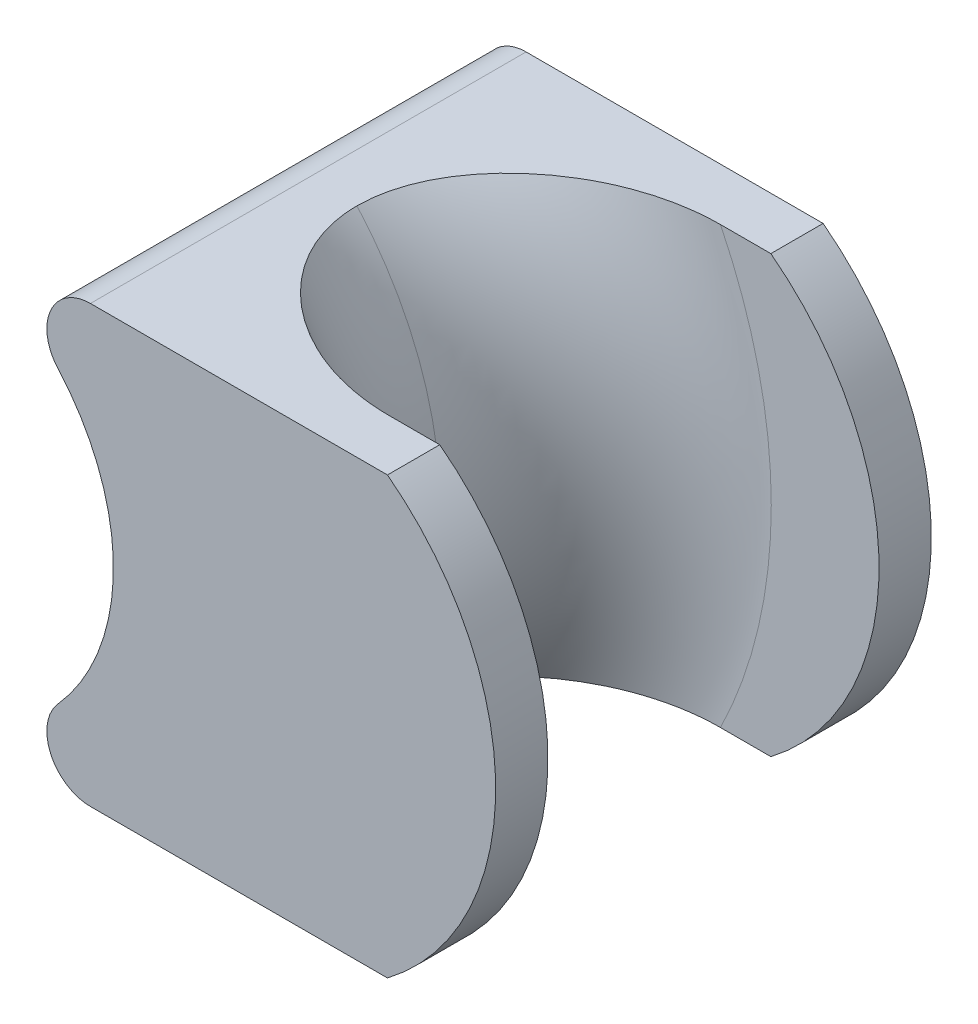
SolidWorks part; units mm, degrees
ref_plane "Front" through (0, 0, 0) normal (0, 0, 1) x (1, 0, 0)
ref_plane "Top" through (0, 0, 0) normal (0, 1, 0) x (1, 0, 0)
ref_plane "Right" through (0, 0, 0) normal (1, 0, 0) x (0, 0, -1)
sketch "Sketch1" plane through (0, 0, 0) normal (0, 0, 1) x (1, 0, 0)
  line L0 (0, -9.525) -> (0, 9.525) construction
  line L1 (0, 6.35) -> (7.0995, 6.35)
  line L2 (0, -6.35) -> (7.0995, -6.35)
  line L3 (0, 6.35) -> (0, -6.35)
  arc A0 (0, 9.525) -> (0, -9.525) centre (0, 0) cw construction
  arc A1 (7.0995, 6.35) -> (6.2141, -7.2188) centre (0, 0) cw
  circle A2 centre (0, 0) radius 6.35
  point P4 (0, 0)
  point P10 (0, 0)
  dimension "D3" = 12.7
  dimension "D1" = 19.05
  dimension "D2" = 12.7
extrude "Boss-Extrude1" add sketch "Sketch1" along normal blind 12.7 contours A1 L1 L3 L2
sketch "Sketch2" plane through (0, 0, 12.7) normal (0, 0, 1) x (1, 0, 0)
  line L0 (7.0995, 6.35) -> (14.3385, 6.35)
  line L1 (7.0995, -6.35) -> (14.3385, -6.35)
  line L7 (0, -6.35) -> (7.0995, -6.35)
  line L8 (7.0995, 6.35) -> (0, 6.35)
  line L11 (0, -6.35) -> (7.0995, -6.35)
  line L12 (7.0995, 6.35) -> (0, 6.35)
  arc A0 (14.3385, 6.35) -> (14.3385, -6.35) centre (9.525, 0) cw
  arc A1 (7.0995, 6.35) -> (7.0995, -6.35) centre (0, 0) cw construction
  arc A3 (0, -6.35) -> (0, 6.35) centre (0, 0) ccw
  arc A4 (7.0995, -6.35) -> (7.0995, 6.35) centre (0, 0) ccw
  arc A5 (0, -6.35) -> (0, 6.35) centre (0, 0) ccw
  dimension "D1" = 7.239
  dimension "D2" = 0
extrude "Boss-Extrude2" add sketch "Sketch2" against normal blind 1.524
ref_plane "Plane1" through (0, 0, 6.35) normal (0, 0, 1) x (1, 0, 0)
fillet "Fillet1" radius 4.826 1 edges at (9.525, 0, 11.176)
mirror "Mirror2" about plane through (0, 0, 6.35) normal (0, 0, 1) of "Boss-Extrude2", "Fillet1"
fillet "Fillet2" radius 1.27 2 edges at (0, -6.35, 6.35) (0, 6.35, 6.35)
